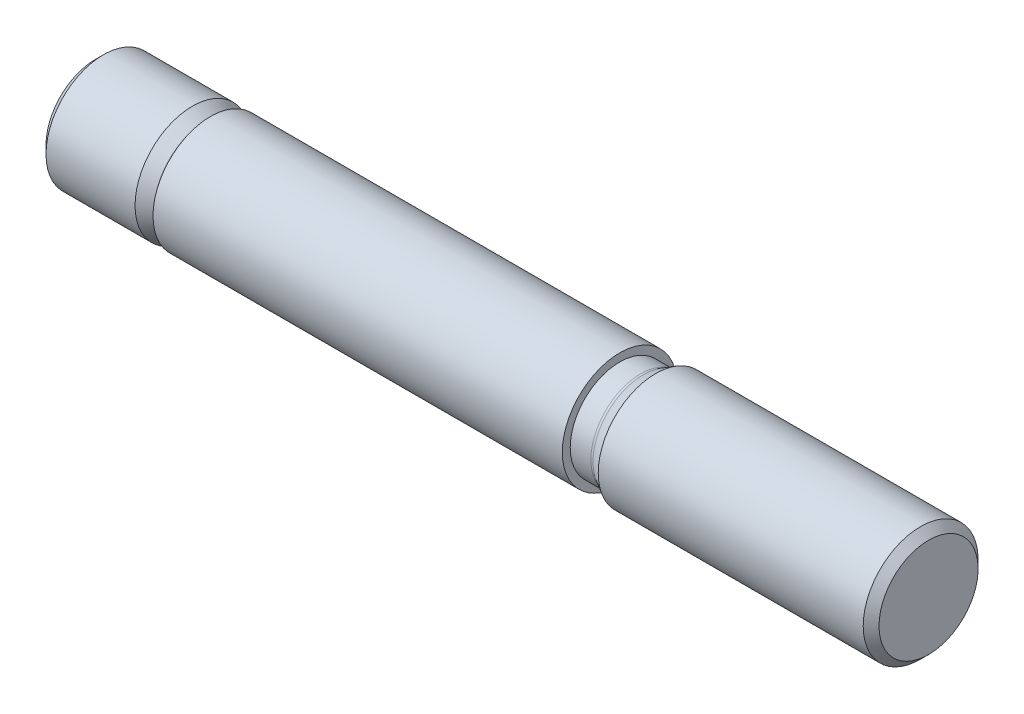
SolidWorks part; units mm, degrees
revolve "BaseBody" add sketch "BodySke" angle 360 about L14
sketch "BodySke" plane through (0, 0, 0) normal (0, 0, 1) x (1, 0, 0)
  line L0 (15.2222, 7.0057) -> (13.5, 8)
  line L1 (13.5, 8) -> (1.1015, 8)
  line L2 (16, 8) -> (16, 6.8985)
  line L3 (16, 6.8985) -> (15.6222, 6.8985)
  line L5 (1.1015, 8) -> (0, 6.8985)
  line L7 (73, 8) -> (73, 6.8985)
  line L8 (73, 6.8985) -> (75.8778, 6.8985)
  line L9 (76.2778, 7.0057) -> (78, 8)
  line L10 (78, 8) -> (114.8985, 8)
  line L11 (114.8985, 8) -> (116, 6.8985)
  line L12 (116, 6.8985) -> (116, 0)
  line L13 (116, 0) -> (0, 0)
  line L14 (-14.6577, 0) -> (120.6967, 0) construction
  line L15 (102.3794, -6.8985) -> (116, -6.8985) construction
  line L16 (73, -6.8985) -> (76.0921, -6.8985) construction
  line L17 (16, -8) -> (73, -8) construction
  line L18 (0, 6.8985) -> (0, 0)
  line L19 (16, 8) -> (73, 8)
  line L20 (78.0921, 11.7499) -> (78.0921, -5.6029) construction
  arc A0 (15.6222, 6.8985) -> (15.2222, 7.0057) centre (15.6222, 7.6985) cw
  arc A2 (75.8778, 6.8985) -> (76.2778, 7.0057) centre (75.8778, 7.6985) ccw
  point P26 (76.0921, 6.8985)
  point P29 (73, 6.8985)
ref_plane "Plane1" through (0, 0, 0) normal (0, 0, 1) x (1, 0, 0)
ref_plane "Plane2" through (0, 0, 0) normal (0, 1, 0) x (1, 0, 0)
ref_plane "Plane3" through (0, 0, 0) normal (1, 0, 0) x (0, 0, -1)
sketch "ThdSchSke" plane through (0, 0, 0) normal (0, 0, 1) x (1, 0, 0)
  line L0 (78, -6.8985) -> (77.2287, -8)
  line L1 (78, -6.8985) -> (78.7713, -8)
  line L2 (78.7713, -8) -> (78.7713, -10)
  line L3 (-3.175, 0) -> (5.1513, 0) construction
  line L5 (78.7713, -10) -> (77.2287, -10)
  line L6 (77.2287, -10) -> (77.2287, -8)
  line L7 (116, -6.8985) -> (116, 6.8985) construction
revolve "ThreadSchematic" [suppressed] cut sketch "ThdSchSke" angle 360 about L3
pattern_linear "ThdSchPat" [suppressed]
sketch "ThdSchSketStud" plane through (0, 0, 0) normal (0, 0, 1) x (1, 0, 0)
  line L0 (13.5, -6.8985) -> (12.7287, -8)
  line L1 (13.5, -6.8985) -> (14.2713, -8)
  line L2 (14.2713, -8) -> (14.2713, -10)
  line L3 (-3.175, 0) -> (5.1513, 0) construction
  line L5 (14.2713, -10) -> (12.7287, -10)
  line L6 (12.7287, -10) -> (12.7287, -8)
  line L7 (0, 6.8985) -> (0, -6.8985) construction
revolve "ThreadSchematicStud" [suppressed] cut sketch "ThdSchSketStud" angle 360 about L3
pattern_linear "ThdSchPatStud" [suppressed]
equation "\"Thread_minor@ThreadCosmetic\" = \"Minor_dia@BodySke\""
equation "\"Thrd_Minor@ThreadCosmeticStud\" = \"Thread_minor@ThreadCosmetic\""
equation "\"Thread_minor@ThdSchSke\" = \"Minor_dia@BodySke\""
equation "\"Diameter@ThdSchSke\" = \"Thread_dia@BodySke\""
equation "\"Overcut@ThdSchSke\" = \"Thread_dia@BodySke\" * 1.25"
equation "\"Start@ThdSchSke\" = \"Thread_nom@BodySke\""
equation "\"Num_threads@ThdSchPat\" = int( \"Start@ThdSchSke\" / \"Advance@BodySke\" + 0.999 ) + 1"
equation "\"Advance@ThdSchPat\" = \"Start@ThdSchSke\" /  ( \"Num_threads@ThdSchPat\" - 1 ) 'relax it"
equation "'  \"Num_threads@ThdSchPat\" = \"Num_threads@ThdSchPat\" - sgn( \"Num_threads@ThdSchPat\" - 1 ) '---chamfered tips only---"
equation "\"Diameter@ThdSchSketStud\" = \"Diameter@ThdSchSke\""
equation "\"Thread_minor@ThdSchSketStud\" = \"Thread_minor@ThdSchSke\""
equation "\"Overcut@ThdSchSketStud\" = \"Overcut@ThdSchSke\""
equation "\"Start_@ThdSchSketStud\"= \"Studend_length@BodySke\" - \"Shoulder_neck_width@BodySke\""
equation "\"Num_Threads@ThdSchPatStud\" = int ( \"Start_@ThdSchSketStud\" / \"Advance@BodySke\" + 0.999 )  + 1"
equation "\"Advance@ThdSchPatStud\" = \"Start_@ThdSchSketStud\" /  ( \"Num_Threads@ThdSchPatStud\" - 1 ) 'relax it"
